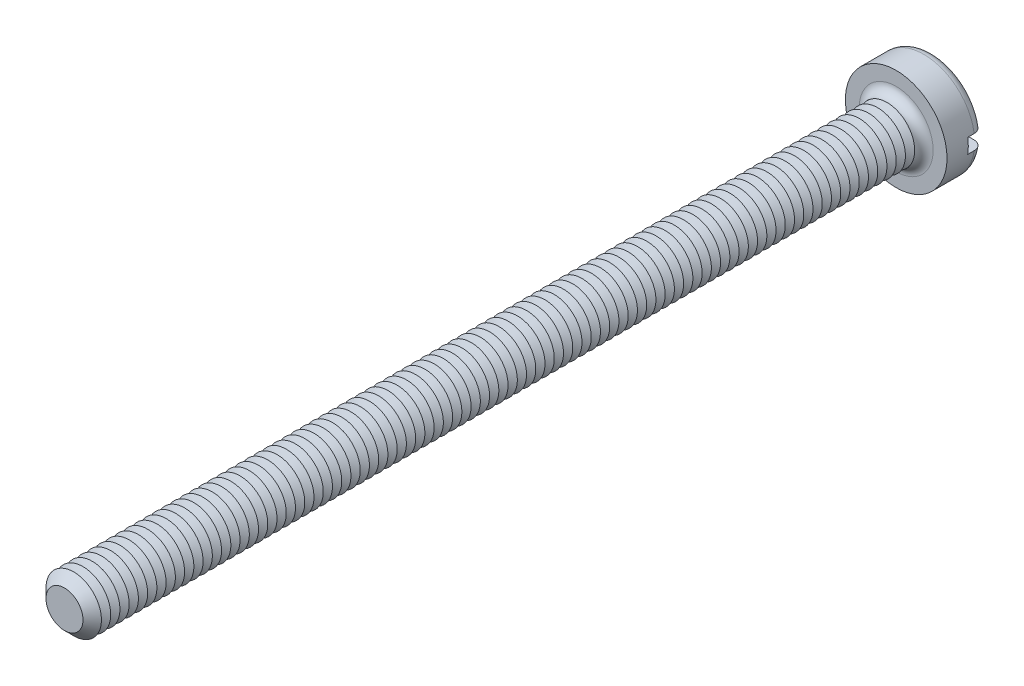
SolidWorks part; units mm, degrees
ref_plane "Front Plane" through (0, 0, 0) normal (0, 0, 1) x (1, 0, 0)
ref_plane "Top Plane" through (0, 0, 0) normal (0, 1, 0) x (1, 0, 0)
ref_plane "Right Plane" through (0, 0, 0) normal (1, 0, 0) x (0, 0, -1)
sketch "Sketch3" plane through (0, 0, 0) normal (0, 0, 1) x (1, 0, 0)
  circle A0 centre (0, 0) radius 2.75
  dimension "D1" = 5.5
extrude "Boss-Extrude2" add sketch "Sketch3" against normal blind 2
sketch "Sketch4" plane through (0, 0, 0) normal (0, 0, 1) x (1, 0, 0)
  circle A0 centre (0, 0) radius 1.5
  dimension "D1" = 3
extrude "Boss-Extrude3" add sketch "Sketch4" along normal blind 45
fillet "Fillet1" radius 0.5 2 edges at (2.75, 0, -2) (1.5, 0, 0)
chamfer "Chamfer1" distance 0.5 angle 45 1 edges at (1.5, 0, 45)
sketch "Sketch5" plane through (0, 0, 0) normal (1, 0, 0) x (0, 0, -1)
  line L0 (1.6944, 0) -> (-7.6738, 0) construction
sketch "Sketch6" plane through (0, 0, 0) normal (1, 0, 0) x (0, 0, -1)
  line L0 (-0.5, 1.5) -> (-0.75, 1.067)
  line L1 (-0.75, 1.067) -> (-1, 1.5)
  line L2 (-0.5, 1.5) -> (-44.5, 1.5) construction
  line L3 (-1, 1.5) -> (-0.5, 1.5)
  dimension "D1" = 0.5
revolve "Cut-Revolve1" cut sketch "Sketch6" angle 360 about L0
pattern_linear "LPattern1" count 88 spacing 0.5 along (0, 0, 1) of "Cut-Revolve1"
sketch "Sketch8" plane through (0, 0, -2) normal (0, 0, -1) x (-1, 0, 0)
  line L1 (2.75, -0.4) -> (-2.75, -0.4)
  line L2 (2.75, -0.4) -> (2.75, 0.4)
  line L3 (2.75, 0.4) -> (-2.75, 0.4)
  line L4 (-2.75, -0.4) -> (-2.75, 0.4)
  line L5 (2.75, -0.4) -> (-2.75, 0.4) construction
  line L6 (2.75, 0.4) -> (-2.75, -0.4) construction
  point P0 (0, 0)
  dimension "D1" = 5.5
  dimension "D2" = 0.8
extrude "Cut-Extrude1" cut sketch "Sketch8" against normal blind 0.85
